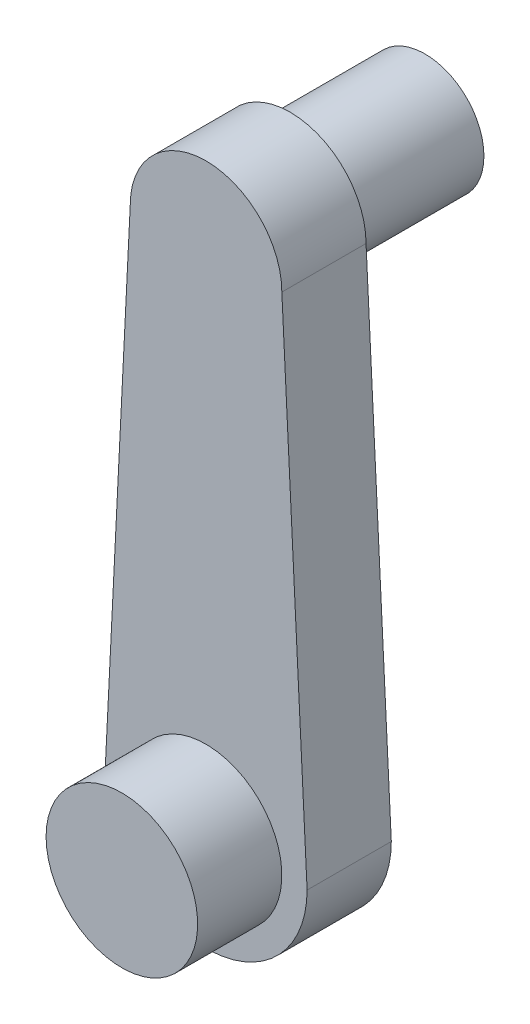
SolidWorks part; units mm, degrees
ref_plane "Front Plane" through (0, 0, 0) normal (0, 0, 1) x (1, 0, 0)
ref_plane "Top Plane" through (0, 0, 0) normal (0, 1, 0) x (1, 0, 0)
ref_plane "Right Plane" through (0, 0, 0) normal (1, 0, 0) x (0, 0, -1)
sketch "Sketch1" plane through (0, 0, 0) normal (0, 0, 1) x (1, 0, 0)
  line L0 (-11.43, 76.2) -> (-15.24, 0)
  line L1 (11.43, 76.2) -> (15.24, 0)
  arc A0 (15.24, 0) -> (-15.24, 0) centre (0, 0) cw
  arc A1 (11.43, 76.2) -> (-11.43, 76.2) centre (0, 76.2) ccw
  dimension "D1" = 11.43
  dimension "D2" = 15.24
  dimension "D3" = 76.2
extrude "Base-Extrude" add sketch "Sketch1" along normal blind 12.7
sketch "Sketch2" plane through (0, 0, 0) normal (0, 0, -1) x (-1, 0, 0)
  circle A0 centre (0, 76.2) radius 8.89
  arc A1 (11.43, 76.2) -> (-11.43, 76.2) centre (0, 76.2) ccw construction
  dimension "D1" = 17.78
extrude "Boss-Extrude1" add sketch "Sketch2" along normal blind 20.32
sketch "Sketch3" plane through (0, 0, 12.7) normal (0, 0, 1) x (1, 0, 0)
  circle A0 centre (0, 0) radius 11.43
  dimension "D1" = 22.86
extrude "Boss-Extrude2" add sketch "Sketch3" along normal blind 12.7
